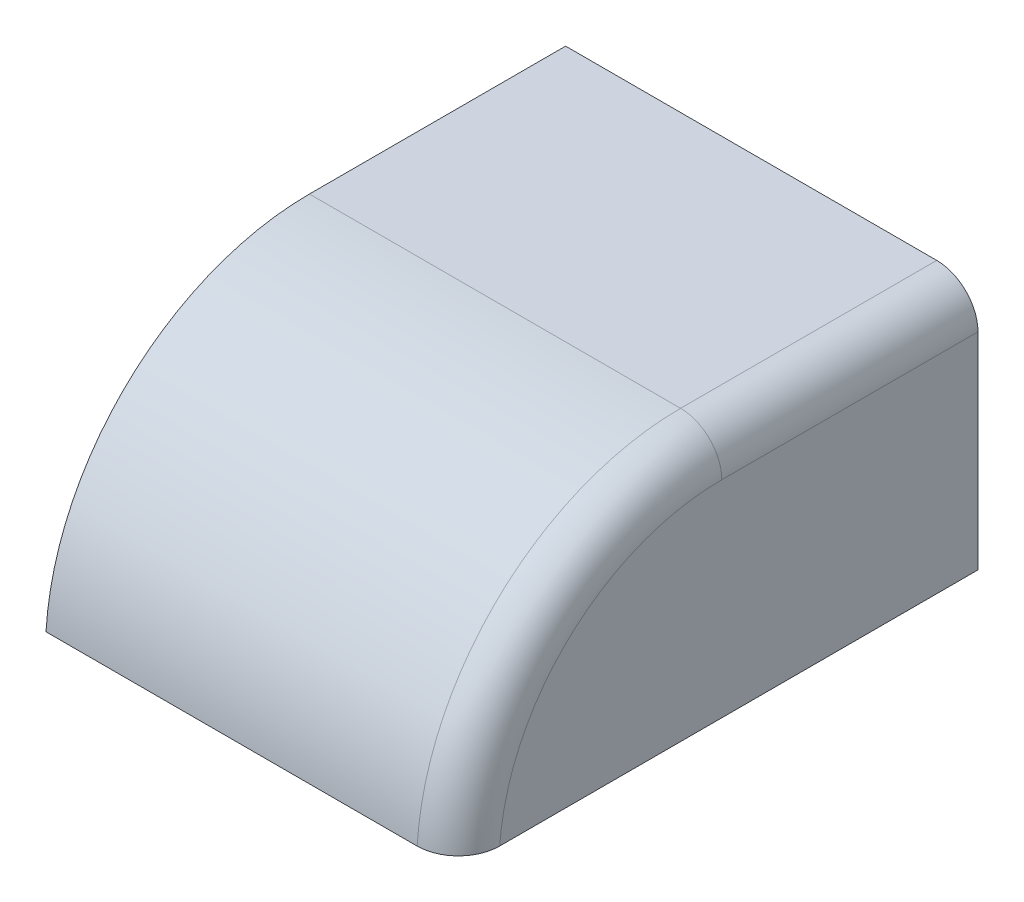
SolidWorks part; units mm, degrees
ref_plane "Front Plane" through (0, 0, 0) normal (0, 0, 1) x (1, 0, 0)
ref_plane "Top Plane" through (0, 0, 0) normal (0, 1, 0) x (1, 0, 0)
ref_plane "Right Plane" through (0, 0, 0) normal (1, 0, 0) x (0, 0, -1)
sketch "Sketch1" plane through (0, 0, 0) normal (0, 0, 1) x (1, 0, 0)
  line L1 (0, 0) -> (50, 0)
  line L2 (0, 0) -> (0, 30)
  line L3 (0, 30) -> (50, 30)
  line L4 (50, 0) -> (50, 30)
  dimension "D1" = 50
  dimension "D2" = 30
extrude "Extrude1" add sketch "Sketch1" along normal blind 63
sketch "Sketch4" plane through (0, 30, 0) normal (0, 1, 0) x (-1, 0, 0)
  line L0 (-25, 0) -> (-25, 63) construction
  line L1 (-50, 0) -> (0, 0) construction
  line L2 (-50, 63) -> (0, 63) construction
  circle A0 centre (-25, 43) radius 7.5
  dimension "D1" = 20
  dimension "D2" = 15
extrude "Extrude4" add sketch "Sketch4" along normal blind 10
sketch "Sketch5" plane through (0, 30, 0) normal (0, 1, 0) x (-1, 0, 0)
  line L0 (-50, 63) -> (-50, 0) construction
  line L1 (-50, 63) -> (0, 63) construction
  circle A0 centre (-40, 53) radius 5
  dimension "D3" = 10
  dimension "D1" = 10
  dimension "D2" = 10
extrude "Cut-Extrude1" cut sketch "Sketch5" against normal blind 10
fillet "Fillet5" radius 32 1 edges at (25, 30, 63)
fillet "Fillet6" radius 5 2 edges at (50, 21.3238, 52.9715) (50, 30, 15.5313)
